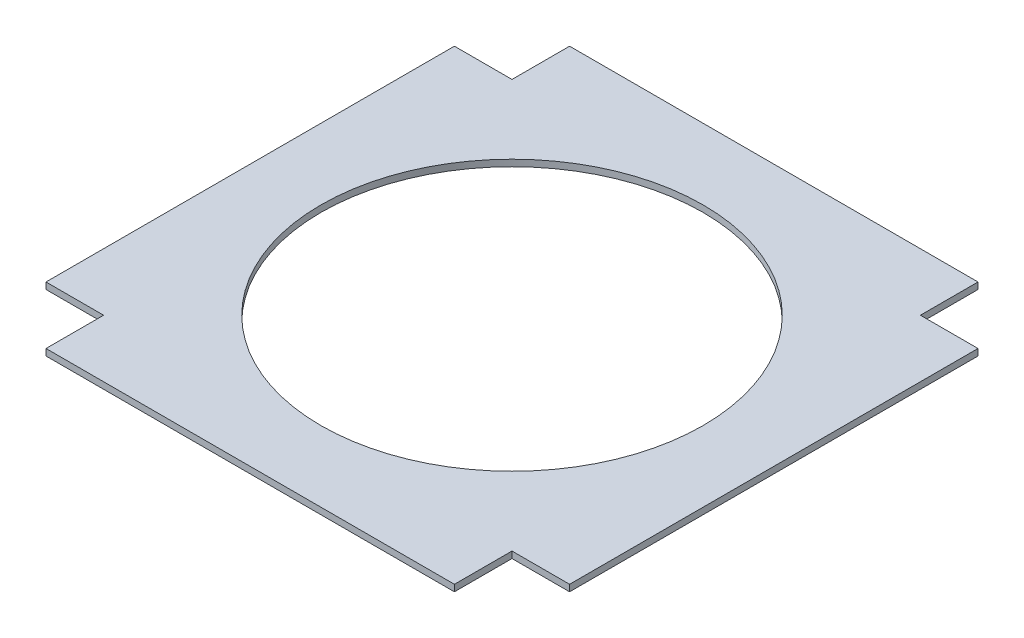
SolidWorks part; units mm, degrees
ref_plane "Front Plane" through (0, 0, 0) normal (0, 0, 1) x (1, 0, 0)
ref_plane "Top Plane" through (0, 0, 0) normal (0, 1, 0) x (1, 0, 0)
ref_plane "Right Plane" through (0, 0, 0) normal (1, 0, 0) x (0, 0, -1)
sketch "Sketch1" plane through (0, 0, 0) normal (0, 1, 0) x (1, 0, 0)
  line L0 (-127, 0) -> (127, 0) construction
  line L1 (-127, -127) -> (127, -127)
  line L2 (-127, -127) -> (-127, 127)
  line L3 (-127, 127) -> (127, 127)
  line L4 (127, -127) -> (127, 127)
  line L5 (-127, -127) -> (127, 127) construction
  line L6 (-127, 127) -> (127, -127) construction
  line L7 (0, 92.71) -> (0, -127) construction
  line L8 (-127, -99.06) -> (-99.06, -99.06)
  line L13 (-127, 127) -> (-99.06, 127)
  line L14 (-127, 127) -> (-127, 99.06)
  line L15 (-127, 99.06) -> (-99.06, 99.06)
  line L16 (-99.06, 127) -> (-99.06, 99.06)
  line L17 (127, 127) -> (99.06, 127)
  line L18 (127, 127) -> (127, 99.06)
  line L19 (127, 99.06) -> (99.06, 99.06)
  line L20 (99.06, 127) -> (99.06, 99.06)
  line L21 (-99.06, -127) -> (-99.06, -99.06)
  line L22 (127, -99.06) -> (99.06, -99.06)
  line L23 (99.06, -127) -> (99.06, -99.06)
  circle A0 centre (0, 0) radius 92.71
  point P0 (0, 0)
  dimension "D5" = 185.42
  dimension "D1" = 254
  dimension "D2" = 254
  dimension "D3" = 27.94
  dimension "D4" = 27.94
extrude "Boss-Extrude1" add sketch "Sketch1" along normal blind 3.175 contours L1 L23 L22 L4 L19 L20 L3 L16 L15 L2 L8 L21 A0
